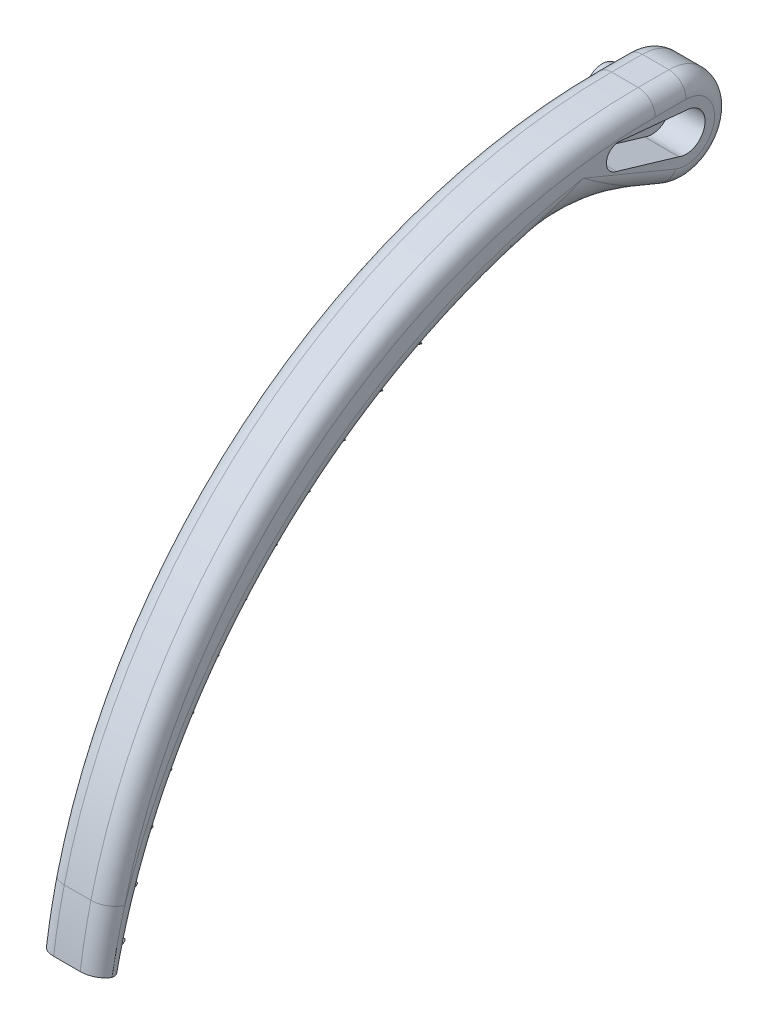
SolidWorks part; units mm, degrees
ref_plane "Front Plane" through (0, 0, 0) normal (0, 0, 1) x (1, 0, 0)
ref_plane "Top Plane" through (0, 0, 0) normal (0, 1, 0) x (1, 0, 0)
ref_plane "Right Plane" through (0, 0, 0) normal (1, 0, 0) x (0, 0, -1)
sketch "Sketch1" plane through (0, 0, 0) normal (1, 0, 0) x (0, 0, -1)
  line L0 (0, 0) -> (0, -6) construction
  line L1 (0, 0) -> (0, 6) construction
  line L2 (0, 12) -> (-27.5, 12)
  line L3 (-27.5, 12) -> (-27.5, -1.6243) construction
  line L4 (-27.5, -1.6243) -> (-4.5, -11.1243)
  line L7 (-155, -118) -> (-147, -118)
  circle A0 centre (0, 0) radius 3 construction
  arc A2 (-4.5, -11.1243) -> (0, 12) centre (0, 0) ccw
  arc A4 (-27.5, -1.6243) -> (-147, -118) centre (-0.2661, -149.1313) ccw
  arc A5 (-27.5, 12) -> (-155, -118) centre (-6.1417, -136.4716) ccw
  dimension "D1" = 6
  dimension "D2" = 24
  dimension "D3" = 150
  dimension "D7" = 150
  dimension "D4" = 155
  dimension "D5" = 6
  dimension "D6" = 23
  dimension "D8" = 130
  dimension "D9" = 9.5
  dimension "D10" = 27.5
  dimension "D11" = 8
extrude "Boss-Extrude1" add sketch "Sketch1" along normal blind 12
sketch "Sketch9" plane through (0, 0, 0) normal (-1, 0, 0) x (0, 0, 1)
  circle A0 centre (0, 0) radius 12
  dimension "D1" = 24
extrude "Boss-Extrude7" add sketch "Sketch9" along normal blind 2
sketch "Sketch11" plane through (-2, 0, 0) normal (-1, 0, 0) x (0, 0, 1)
  circle A0 centre (0, 0) radius 4.625
  dimension "D1" = 9.25
extrude "Boss-Extrude8" add sketch "Sketch11" along normal blind 6
sketch "Sketch12" plane through (12, 0, 0) normal (1, 0, 0) x (0, 0, -1)
  circle A0 centre (0, 0) radius 12
  dimension "D1" = 24
extrude "Boss-Extrude9" add sketch "Sketch12" along normal blind 2
sketch "Sketch13" plane through (14, 0, 0) normal (1, 0, 0) x (0, 0, -1)
  circle A0 centre (0, 0) radius 4.5
  dimension "D1" = 9
extrude "Boss-Extrude10" add sketch "Sketch13" along normal blind 3
sketch "Sketch16" plane through (-8, 0, 0) normal (-1, 0, 0) x (0, 0, 1)
  circle A0 centre (0, 0) radius 3
  dimension "D1" = 6
sketch "Sketch17" plane through (-2, 0, 0) normal (-1, 0, 0) x (0, 0, 1)
  line L0 (0, 0) -> (38.637, 10.3528) construction
  line L1 (0, 0) -> (50, 0) construction
  dimension "D1" = 40
  dimension "D2" = 50
  dimension "D3" = 15
sketch "Sketch19" plane through (0, 0, 0) normal (-1, 0, 0) x (0, 0, 1)
  line L2 (147, -118) -> (155, -118)
  line L3 (27.5, 12) -> (0, 12)
  line L4 (147, -118) -> (155, -118)
  line L5 (27.5, 12) -> (0, 12)
  line L7 (4.662, -11.0574) -> (27.5, -1.6243)
  line L8 (4.662, -11.0574) -> (27.5, -1.6243)
  arc A3 (4.662, -11.0574) -> (0, 12) centre (0, 0) ccw
  arc A4 (147, -118) -> (27.5, -1.6243) centre (0.2661, -149.1313) ccw
  arc A5 (155, -118) -> (27.5, 12) centre (6.1417, -136.4716) ccw
  arc A6 (4.662, -11.0574) -> (0, 12) centre (0, 0) ccw
  arc A7 (147, -118) -> (27.5, -1.6243) centre (0.2661, -149.1313) ccw
  arc A8 (155, -118) -> (27.5, 12) centre (6.1417, -136.4716) ccw
  dimension "D1" = 0
extrude "Boss-Extrude11" add sketch "Sketch19" along normal blind 2
sketch "Sketch20" plane through (12, 0, 0) normal (1, 0, 0) x (0, 0, -1)
  line L2 (0, 12) -> (-27.5, 12)
  line L3 (-155, -118) -> (-147, -118)
  line L4 (0, 12) -> (-27.5, 12)
  line L5 (-155, -118) -> (-147, -118)
  line L7 (-27.5, -1.6243) -> (-4.662, -11.0574)
  line L8 (-27.5, -1.6243) -> (-4.662, -11.0574)
  arc A3 (0, 12) -> (-4.662, -11.0574) centre (0, 0) ccw
  arc A4 (-27.5, 12) -> (-155, -118) centre (-6.1417, -136.4716) ccw
  arc A5 (-27.5, -1.6243) -> (-147, -118) centre (-0.2661, -149.1313) ccw
  arc A6 (0, 12) -> (-4.662, -11.0574) centre (0, 0) ccw
  arc A7 (-27.5, 12) -> (-155, -118) centre (-6.1417, -136.4716) ccw
  arc A8 (-27.5, -1.6243) -> (-147, -118) centre (-0.2661, -149.1313) ccw
  dimension "D1" = 0
extrude "Boss-Extrude12" add sketch "Sketch20" along normal blind 2
fillet "Fillet1" radius 4.5 10 edges at (-2, 12, 13.75) (14, 12, 13.75) (-2, -2.3782, -11.762) (14, -2.3782, -11.762) (-2, -6.3408, 16.081) (14, -6.3408, 16.081) (-2, -31.4403, 113.2324) (14, -31.4403, 113.2324) (-2, -41.6698, 104.918) (14, -41.6698, 104.918)
fillet "Fillet2" radius 59 3 edges at (12.2251, -0.6715, 27.3996) (-0.2251, -0.6715, 27.3996) (6, -1.6243, 27.5)
sketch "Sketch22" plane through (-2, 0, 0) normal (-1, 0, 0) x (0, 0, 1)
  line L0 (147, -118) -> (155, -118)
  line L1 (155, -118) -> (155, -115.8564)
  line L2 (147, -118) -> (155, -115.8564)
  dimension "D1" = 15
extrude "Cut-Extrude5" cut sketch "Sketch22" against normal through all
ref_plane "Plane1" through (2.5, 0, 0) normal (-1, 0, 0) x (0, 0, 1)
sketch "Sketch25" plane through (0, -146.8455, 39.3471) normal (0, -0.9659, 0.2588) x (1, 0, 0)
  line L0 (2.5, 111.4504) -> (2.5, 119.4515) construction
sketch "Sketch26" plane through (2.5, 0, 0) normal (-1, 0, 0) x (0, 0, 1)
  line L0 (147, -118) -> (142.101, -115.1716)
  line L1 (142.101, -115.1716) -> (146.117, -114.0955)
  line L2 (147, -118) -> (154.7284, -115.9292) construction
  line L3 (146.117, -114.0955) -> (148.8625, -113.3598)
  line L4 (148.8625, -113.3598) -> (149.8978, -117.2235)
  line L5 (149.8978, -117.2235) -> (147, -118)
  arc A0 (147, -118) -> (52.0623, -8.3579) centre (0.2661, -149.1313) ccw construction
  dimension "D1" = 45
  dimension "D2" = 4
  dimension "D3" = 3
extrude "Boss-Extrude14" add sketch "Sketch26" against normal blind 7
fillet "Fillet3" radius 1 4 edges at (2.5, -116.5858, 144.5505) (9.5, -116.5858, 144.5505) (9.5, -114.6335, 144.109) (2.5, -114.6335, 144.109)
pattern_curve "CrvPattern4" of "Boss-Extrude14", "Fillet3" parameters "D1"=12, "D3"=12, "D2"=1, "D4"=10
fillet "Fillet5" radius 148 3 edges at (-0.3057, 11.0182, 27.4296) (12.3057, 11.0182, 27.4296) (6, 12, 27.5)
sketch "Sketch28" plane through (17, 0, 0) normal (1, 0, 0) x (0, 0, -1)
  line L0 (0, 0) -> (-1.3995, 0.2709) construction
  line L2 (-2.799, -6.9581) -> (0, 7.5) construction
  line L3 (-1.3995, 0.2709) -> (-17.6719, 3.4212) construction
  line L4 (-17.0542, 6.612) -> (-17.6719, 3.4212) construction
  line L5 (-17.6719, 3.4212) -> (-18.2896, 0.2305) construction
  line L6 (-18.2896, 0.2305) -> (-17.6719, 3.4212) construction
  line L7 (0, 0) -> (0.9503, 4.9089) construction
  line L8 (0, 0) -> (-0.9503, -4.9089) construction
  line L9 (-17.0542, 6.612) -> (-0.013, 5)
  line L10 (-18.2896, 0.2305) -> (-1.8781, -4.6339)
  arc A0 (-17.0542, 6.612) -> (-18.2896, 0.2305) centre (-17.6719, 3.4212) ccw
  arc A1 (-1.8781, -4.6339) -> (-0.013, 5) centre (0, 0) ccw
  dimension "D2" = 10
  dimension "D3" = 6.5
  dimension "D1" = 18
extrude "Cut-Extrude6" cut sketch "Sketch28" against normal blind 12
sketch "Sketch29" plane through (5, 0, 0) normal (1, 0, 0) x (0, 0, -1)
  circle A0 centre (-17.6719, 3.4212) radius 1.55
  dimension "D1" = 3.1
extrude "Cut-Extrude7" cut sketch "Sketch29" against normal through all
extrude "Cut-Extrude8" cut sketch "Sketch16" against normal blind 11 contours A0
sketch "Sketch30" plane through (3, 0, 0) normal (-1, 0, 0) x (0, 0, 1)
  circle A0 centre (0, 0) radius 1.55
  dimension "D1" = 3.1
extrude "Cut-Extrude9" cut sketch "Sketch30" against normal through all
sketch "Sketch31" plane through (-2, 0, 0) normal (-1, 0, 0) x (0, 0, 1)
  circle A0 centre (17.6719, 3.4212) radius 2.8
  dimension "D1" = 5.6
extrude "Cut-Extrude10" cut sketch "Sketch31" against normal blind 3
